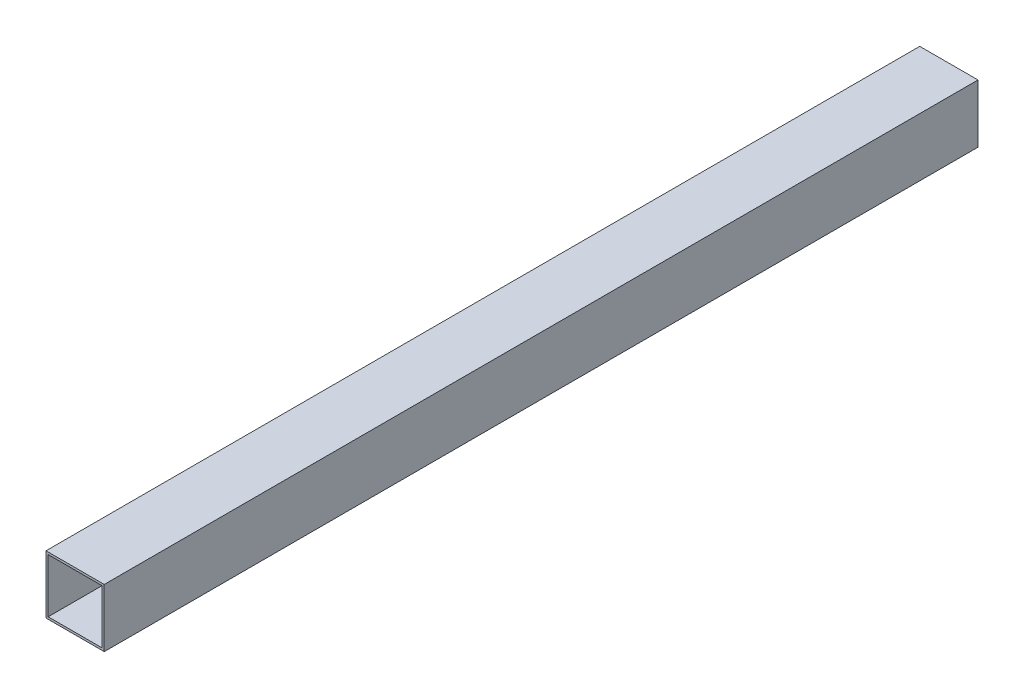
SolidWorks part; units mm, degrees
ref_plane "Plan de face" through (0, 0, 0) normal (0, 0, 1) x (1, 0, 0)
ref_plane "Plan de dessus" through (0, 0, 0) normal (0, 1, 0) x (1, 0, 0)
ref_plane "Plan de droite" through (0, 0, 0) normal (1, 0, 0) x (0, 0, -1)
sketch "Esquisse1" plane through (0, 0, 0) normal (0, 0, 1) x (1, 0, 0)
  line L1 (0, 0) -> (80, 0)
  line L2 (0, 0) -> (0, 80)
  line L3 (0, 80) -> (80, 80)
  line L4 (80, 0) -> (80, 80)
  line L5 (3, 77) -> (77, 77)
  line L6 (3, 77) -> (3, 3)
  line L7 (3, 3) -> (77, 3)
  line L8 (77, 77) -> (77, 3)
  dimension "D1" = 80
  dimension "D2" = 80
  dimension "D3" = 3
  dimension "D4" = 3
  dimension "D5" = 3
  dimension "D6" = 3
extrude "Extrusion1" add sketch "Esquisse1" along normal blind 1200
ref_plane "Plan1" through (0, 0, 600) normal (0, 0, 1) x (1, 0, 0)
